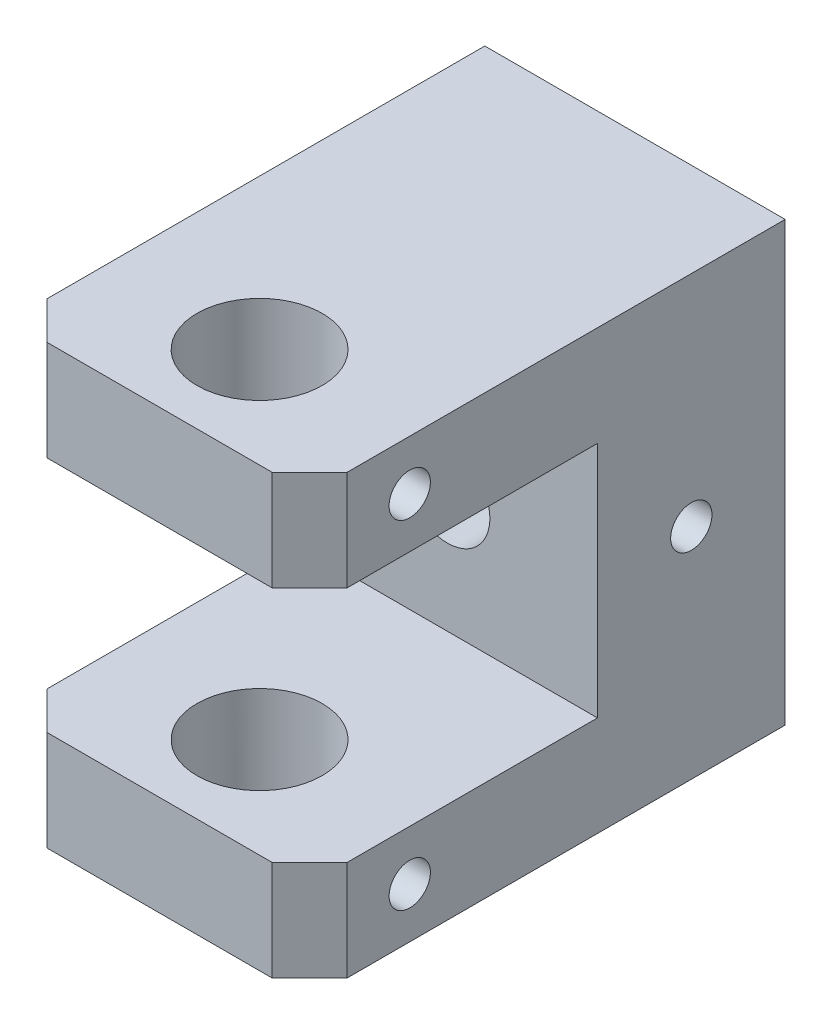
SolidWorks part; units mm, degrees
ref_plane "前视基准面" through (0, 0, 0) normal (0, 0, 1) x (1, 0, 0)
ref_plane "上视基准面" through (0, 0, 0) normal (0, 1, 0) x (1, 0, 0)
ref_plane "右视基准面" through (0, 0, 0) normal (1, 0, 0) x (0, 0, -1)
sketch "草图1" plane through (0, 0, 0) normal (0, 1, 0) x (1, 0, 0)
  line L0 (0, 0) -> (0, -55.5832) construction
  line L1 (-12, 0) -> (12, 0)
  line L2 (-12, 0) -> (-12, -38)
  line L3 (-12, -38) -> (12, -38)
  line L4 (12, 0) -> (12, -38)
  dimension "D1" = 24
  dimension "D2" = 38
extrude "凸台-拉伸1" add sketch "草图1" along normal mid plane 35
sketch "草图2" plane through (12, 0, 0) normal (1, 0, 0) x (0, 0, -1)
  line L0 (0, 0) -> (-37.9361, 0) construction
  line L1 (-38, 17.5) -> (-38, -17.5) construction
  line L2 (-38, 9.5) -> (-15, 9.5)
  line L3 (-38, 9.5) -> (-38, -9.5)
  line L4 (-38, -9.5) -> (-15, -9.5)
  line L5 (-15, 9.5) -> (-15, -9.5)
  line L6 (0, 17.5) -> (0, -17.5) construction
  dimension "D1" = 19
  dimension "D2" = 15
extrude "切除-拉伸1" cut sketch "草图2" against normal through all
hole_wizard "Ø10.0 (10) 直径孔1" positions "草图4" profile "草图3" hole size "Ø10.0" standard "Iso"
sketch "草图4" plane through (0, 17.5, 0) normal (0, 1, 0) x (1, 0, 0)
  line L0 (0, 0) -> (0, -40.4339) construction
  line L1 (12, 0) -> (-12, 0) construction
  point P0 (0, -30)
  dimension "D1" = 30
sketch "草图3" plane through (0, 17.5, 30) normal (1, 0, 0) x (0, 0, 1)
  line L0 (0, 0) -> (0, 35)
  line L1 (0, 35) -> (5, 35)
  line L2 (5, 35) -> (5, 0)
  line L5 (5, 0) -> (0, 0)
  line L11 (0, -6.35) -> (0, 107.95) construction
  dimension "通孔孔直径" = 10
  dimension "通孔孔深度" = 35
hole_wizard "M8 螺纹孔1" positions "草图6" profile "草图5" tap size "M8" standard "Iso"
sketch "草图6" plane through (0, 0, 0) normal (0, 0, -1) x (-1, 0, 0)
  point P0 (0, 0)
sketch "草图5" plane through (0, 0, 0) normal (1, 0, 0) x (0, 1, 0)
  line L0 (0, 0) -> (0, 21.7929)
  line L1 (0, 21.7929) -> (3.4, 19.75)
  line L2 (3.4, 19.75) -> (3.4, 0)
  line L5 (3.4, 0) -> (0, 0)
  line L10 (0, 21.7929) -> (-3.4, 19.75) construction
  line L11 (0, -6.35) -> (0, 107.95) construction
  dimension "螺纹孔钻头直径" = 6.8
  dimension "螺纹孔钻头深度" = 19.75
  dimension "导头角度" = 118
hole_wizard "M4 螺纹孔1" positions "草图8" profile "草图7" tap size "M4" standard "Iso"
sketch "草图8" plane through (12, 0, 0) normal (1, 0, 0) x (0, 0, -1)
  line L0 (0, 0) -> (-51.3077, 0) construction
  line L1 (0, 17.5) -> (0, -17.5) construction
  line L2 (-38, 17.5) -> (0, 17.5) construction
  point P0 (-30, 13.5)
  point P11 (-30, -13.5)
  dimension "D1" = 30
  dimension "D2" = 4
sketch "草图7" plane through (12, 13.5, 30) normal (0, 1, 0) x (0, 0, -1)
  line L0 (0, 0) -> (0, 7)
  line L1 (0, 7) -> (1.65, 7)
  line L2 (1.65, 7) -> (1.65, 0)
  line L5 (1.65, 0) -> (0, 0)
  line L11 (0, -6.35) -> (0, 107.95) construction
  dimension "通孔螺纹孔钻头直径" = 3.3
  dimension "通孔螺纹孔钻头深度" = 7
chamfer "倒角1" distance 3 angle 45 4 edges at (12, -13.5, 38) (-12, -13.5, 38) (-12, 13.5, 38) (12, 13.5, 38)
hole_wizard "M4 螺纹孔2" positions "草图10" profile "草图9" tap size "M4" standard "Iso"
sketch "草图10" plane through (12, 0, 0) normal (1, 0, 0) x (0, 0, -1)
  line L0 (0, 0) -> (-31.6129, 0) construction
  line L1 (0, 17.5) -> (0, -17.5) construction
  point P0 (-7.5, 0)
  dimension "D1" = 7.5
sketch "草图9" plane through (12, 0, 7.5) normal (0, 1, 0) x (0, 0, -1)
  line L0 (0, 0) -> (0, 8.6)
  line L1 (0, 8.6) -> (1.65, 8.6)
  line L2 (1.65, 8.6) -> (1.65, 0)
  line L5 (1.65, 0) -> (0, 0)
  line L11 (0, -6.35) -> (0, 107.95) construction
  dimension "通孔螺纹孔钻头直径" = 3.3
  dimension "通孔螺纹孔钻头深度" = 8.6
